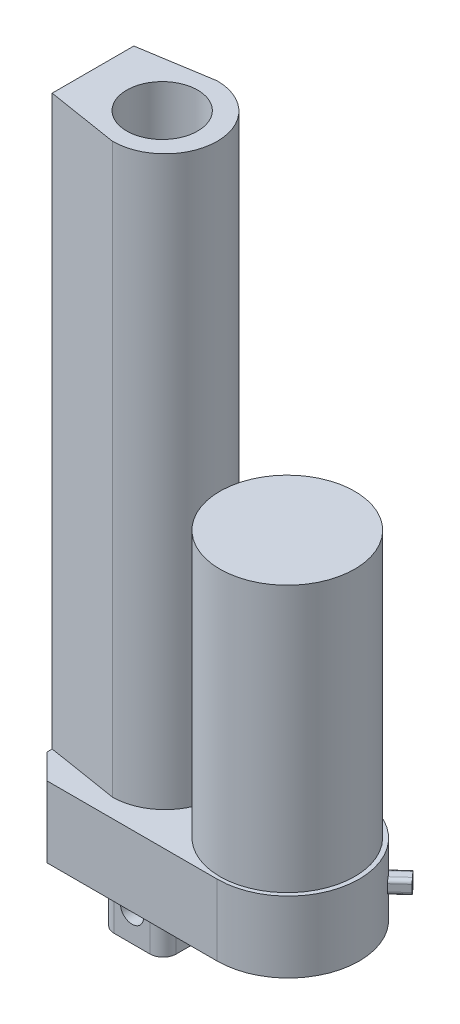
SolidWorks part; units mm, degrees
ref_plane "Front Plane" through (0, 0, 0) normal (0, 0, 1) x (1, 0, 0)
ref_plane "Top Plane" through (0, 0, 0) normal (0, 1, 0) x (1, 0, 0)
ref_plane "Right Plane" through (0, 0, 0) normal (1, 0, 0) x (0, 0, -1)
sketch "Sketch2" plane through (0, 0, 0) normal (0, 1, 0) x (1, 0, 0)
  line L0 (0, 20) -> (75, 20) construction
  line L1 (0, 0) -> (55, 0)
  line L2 (0, 0) -> (0, 40)
  line L3 (0, 40) -> (55, 40)
  arc A0 (55, 0) -> (55, 40) centre (55, 20) ccw
  dimension "D1" = 75
  dimension "D2" = 40
extrude "Boss-Extrude1" add sketch "Sketch2" along normal blind 20
sketch "Sketch3" plane through (0, 20, 0) normal (0, 1, 0) x (1, 0, 0)
  line L0 (0, 20) -> (75, 20) construction
  line L1 (0, 40) -> (0, 0) construction
  line L3 (0, 5.25) -> (20.25, 5.25)
  line L4 (0, 5.25) -> (0, 34.75)
  line L5 (0, 34.75) -> (20.25, 34.75)
  line L6 (20.25, 5.25) -> (20.25, 34.75)
  arc A0 (55, 0) -> (55, 40) centre (55, 20) ccw construction
  circle A1 centre (20.25, 20) radius 14.75
  circle A2 centre (55.9188, 20) radius 17.5 construction
  point P14 (35, 20)
  dimension "D2" = 35
  dimension "D3" = 35
  dimension "D1" = 14.75
extrude "Boss-Extrude2" add sketch "Sketch3" along normal offset from surface (160 mm away) 180 contours L6 A1 | L6 A1
sketch "Sketch4" plane through (0, 20, 0) normal (0, 1, 0) x (1, 0, 0)
  line L0 (0, 20) -> (73.7402, 20) construction
  line L2 (0, 5.25) -> (0, 34.75) construction
  circle A0 centre (54.7402, 20) radius 19
  dimension "D1" = 38
extrude "Boss-Extrude3" add sketch "Sketch4" along normal offset from surface (75 mm away) 95
sketch "Sketch6" plane through (0, 0, 0) normal (0, -1, 0) x (-1, 0, 0)
  line L0 (0, 40) -> (0, 0) construction
  line L1 (-28.5, 28.75) -> (-11, 28.75)
  line L2 (-28.5, 28.75) -> (-28.5, 11.25)
  line L3 (-28.5, 11.25) -> (-11, 11.25)
  line L4 (-11, 28.75) -> (-11, 11.25)
  line L5 (-28.5, 28.75) -> (-11, 11.25) construction
  line L6 (-28.5, 11.25) -> (-11, 28.75) construction
  circle A0 centre (-19.75, 20) radius 8.75 construction
  dimension "D1" = 17.5
  dimension "D2" = 11
extrude "Boss-Extrude4" add sketch "Sketch6" along normal blind 19
sketch "Sketch8" plane through (0, 180, 0) normal (0, 1, 0) x (1, 0, 0)
  line L0 (0, 20) -> (35, 20) construction
  line L1 (0, 5.25) -> (20.25, 5.25) construction
  line L2 (0, 5.25) -> (0, 34.75) construction
  line L3 (19.75, 28.75) -> (19.75, 11.25) construction
  line L4 (11, 28.75) -> (28.5, 28.75) construction
  line L5 (28.5, 11.25) -> (11, 11.25) construction
  line L8 (0, 31.5) -> (0, 34.75)
  line L9 (0, 8.5) -> (0, 5.25)
  line L14 (0, 34.75) -> (20.25, 34.75) construction
  line L15 (0, 5.25) -> (20.25, 5.25)
  line L16 (0, 34.75) -> (20.25, 34.75)
  line L17 (20.25, 34.75) -> (0, 31.5)
  line L18 (0, 8.5) -> (20.25, 5.25)
  circle A0 centre (19.75, 19.7521) radius 10
  arc A2 (20.25, 5.25) -> (20.25, 34.75) centre (20.25, 20) ccw construction
  dimension "D1" = 20
  dimension "D2" = 11.5
  dimension "D3" = 11.5
extrude "Cut-Extrude1" cut sketch "Sketch8" against normal up to surface (160 mm away)
sketch "Sketch10" plane through (0, 0, 0) normal (0, 0, 1) x (1, 0, 0)
  line L0 (19.75, -19) -> (19.75, 0) construction
  line L2 (0, 0) -> (55, 0) construction
  line L3 (28.5, -19) -> (11, -19) construction
  circle A0 centre (19.75, -11) radius 3.25
  dimension "D1" = 6.5
  dimension "D2" = 8
extrude "Cut-Extrude2" cut sketch "Sketch10" against normal through all
fillet "Fillet1" radius 3.7 4 edges at (11, -9.5, -28.75) (11, -9.5, -11.25) (28.5, -9.5, -28.75) (28.5, -9.5, -11.25)
ref_plane "Plane1" through (0, 10, 0) normal (0, -1, 0) x (-1, 0, 0)
sketch "Sketch11" plane through (0, 10, 0) normal (0, -1, 0) x (-1, 0, 0)
  line L0 (-55, 20) -> (-76.5908, 39.5621) construction
  line L1 (-63.2613, 30.1839) -> (-72.0476, 38.1446)
  line L2 (-72.0476, 38.1446) -> (-74.7333, 35.1804)
  line L3 (-74.7333, 35.1804) -> (-66.0228, 27.2883)
  line L4 (-66.0228, 27.2883) -> (-63.2613, 30.1839)
  circle A0 centre (-55, 20) radius 16.3758 construction
  dimension "D1" = 2
  dimension "D2" = 2
extrude "Boss-Extrude5" add sketch "Sketch11" along normal blind 2 and the other way blind 2
fillet "Fillet2" radius 1 4 edges at (72.9116, 12, -33.5298) (70.2259, 8, -36.4941) (70.2259, 12, -36.4941) (72.9116, 8, -33.5298)
chamfer "Chamfer1" distance 7 angle 45 2 edges at (0, 10, 0) (0, 10, -40)
ref_plane "Mid-plane" through (0, 0, -20) normal (0, 0, 1) x (1, 0, 0)
